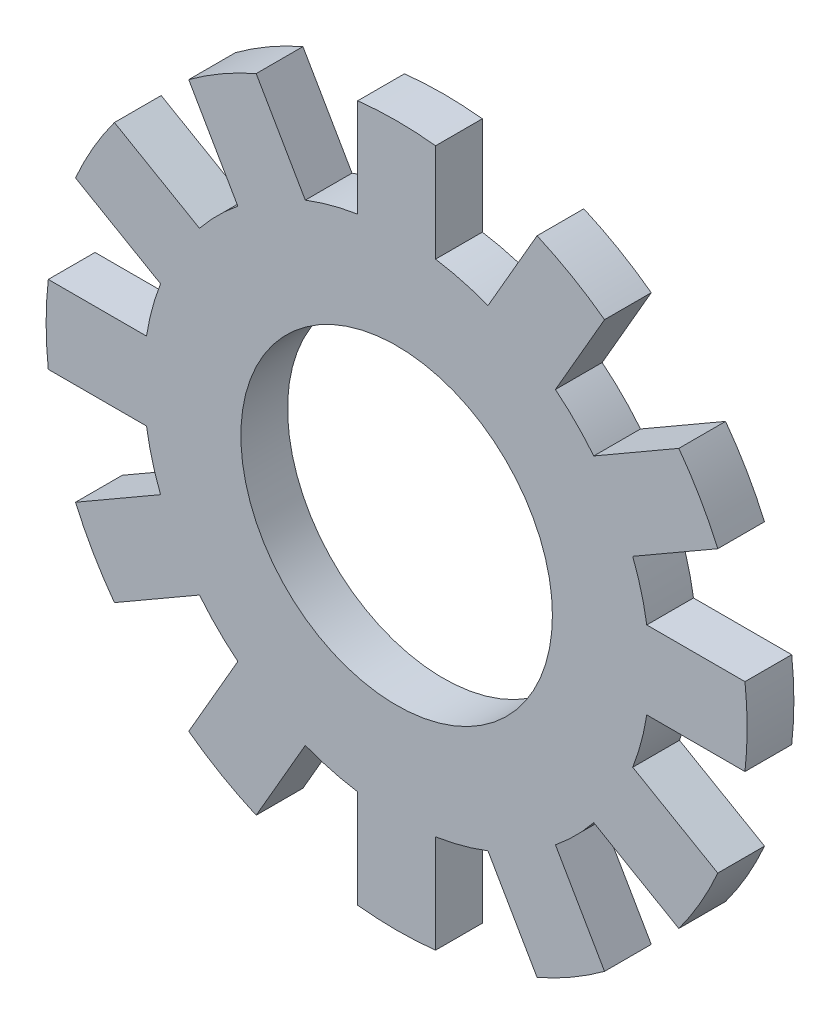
SolidWorks part; units mm, degrees
ref_plane "Front Plane" through (0, 0, 0) normal (0, 0, 1) x (1, 0, 0)
ref_plane "Top Plane" through (0, 0, 0) normal (0, 1, 0) x (1, 0, 0)
ref_plane "Right Plane" through (0, 0, 0) normal (1, 0, 0) x (0, 0, -1)
sketch "Sketch1" plane through (0, 0, 0) normal (0, 0, 1) x (1, 0, 0)
  circle A0 centre (0, 0) radius 1
  circle A1 centre (0, 0) radius 1.625
  dimension "D1" = 2
  dimension "D2" = 3.25
extrude "Boss-Extrude1" add sketch "Sketch1" along normal mid plane 0.3
sketch "Sketch2" plane through (0, 0, 0) normal (0, 0, 1) x (1, 0, 0)
  line L0 (0, 2.6811) -> (0, -2.8425) construction
sketch "Sketch3" plane through (0, 0, 0) normal (0, 0, 1) x (1, 0, 0)
  line L0 (-0.25, 2.2361) -> (-0.25, 1.6057)
  line L2 (0, 2.6811) -> (0, -2.8425) construction
  line L3 (0, 1.625) -> (0, 2.25)
  arc A0 (0, 2.25) -> (-0.25, 2.2361) centre (0, 0) ccw
  arc A1 (0, 1.625) -> (-0.25, 1.6057) centre (0, 0) ccw
  circle A2 centre (0, 0) radius 1.625 construction
  dimension "D2" = 2.25
  dimension "D1" = 0.25
extrude "Boss-Extrude2" add sketch "Sketch3" along normal mid plane 0.3
mirror "Mirror1" about plane through (0, 0, 0) normal (1, 0, 0) of "Boss-Extrude2"
pattern_circular "CirPattern2" count 12 over 360 about axis through (0, 0, 0) along (0, 0, 1) of "Boss-Extrude2", "Mirror1"
